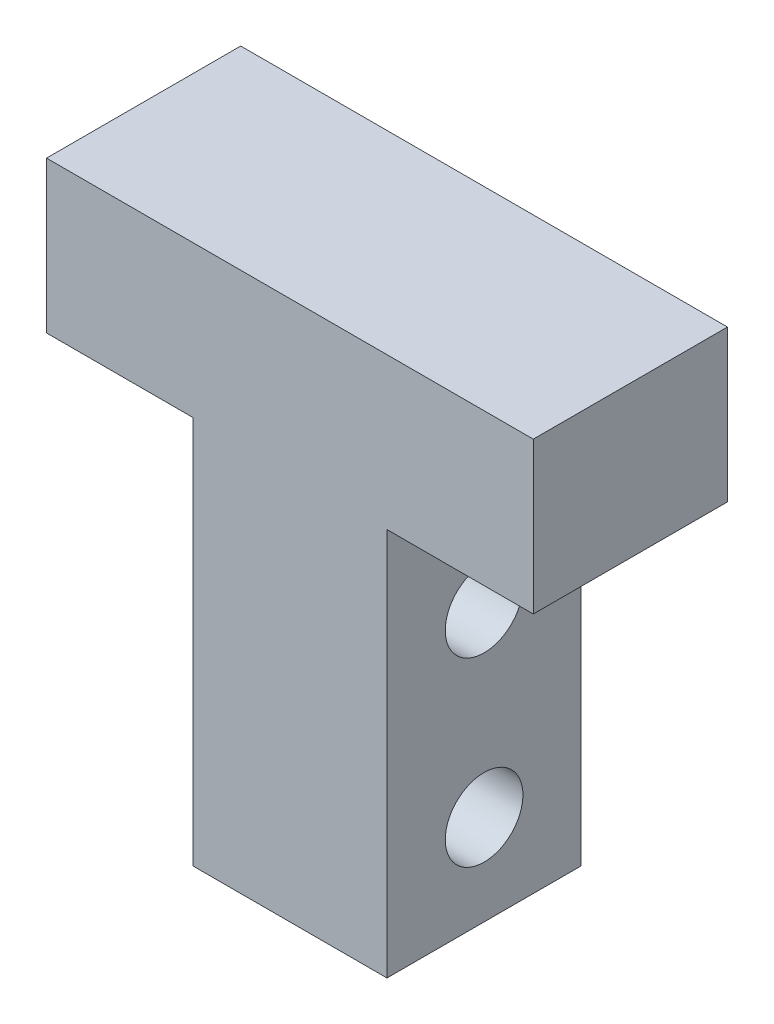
SolidWorks part; units mm, degrees
ref_plane "Front Plane" through (0, 0, 0) normal (0, 0, 1) x (1, 0, 0)
ref_plane "Top Plane" through (0, 0, 0) normal (0, 1, 0) x (1, 0, 0)
ref_plane "Right Plane" through (0, 0, 0) normal (1, 0, 0) x (0, 0, -1)
sketch "Sketch1" plane through (0, 0, 0) normal (0, 0, 1) x (1, 0, 0)
  line L0 (7.5, -5.85) -> (18.8, -5.85)
  line L1 (-18.8, 5.85) -> (18.8, 5.85)
  line L2 (-18.8, 5.85) -> (-18.8, -5.85)
  line L3 (-18.8, -5.85) -> (-7.5, -5.85)
  line L4 (18.8, 5.85) -> (18.8, -5.85)
  line L6 (-7.5, -5.85) -> (-7.5, -35.85)
  line L7 (-7.5, -35.85) -> (7.5, -35.85)
  line L8 (7.5, -5.85) -> (7.5, -35.85)
  dimension "D1" = 37.6
  dimension "D2" = 11.7
  dimension "D3" = 18.8
  dimension "D4" = 5.85
  dimension "D5" = 30
  dimension "D6" = 15
  dimension "D7" = 7.5
extrude "Boss-Extrude1" add sketch "Sketch1" along normal blind 15
sketch "Sketch2" plane through (7.5, 0, 0) normal (1, 0, 0) x (0, 0, -1)
  line L0 (-15, -35.85) -> (0, -35.85) construction
  line L1 (-15, -35.85) -> (-15, -5.85) construction
  circle A0 centre (-7.5, -28.85) radius 3
  circle A1 centre (-7.5, -14.85) radius 3
  dimension "D1" = 6
  dimension "D2" = 6
  dimension "D3" = 7
  dimension "D4" = 14
  dimension "D5" = 7.5
extrude "Cut-Extrude1" cut sketch "Sketch2" against normal through all
